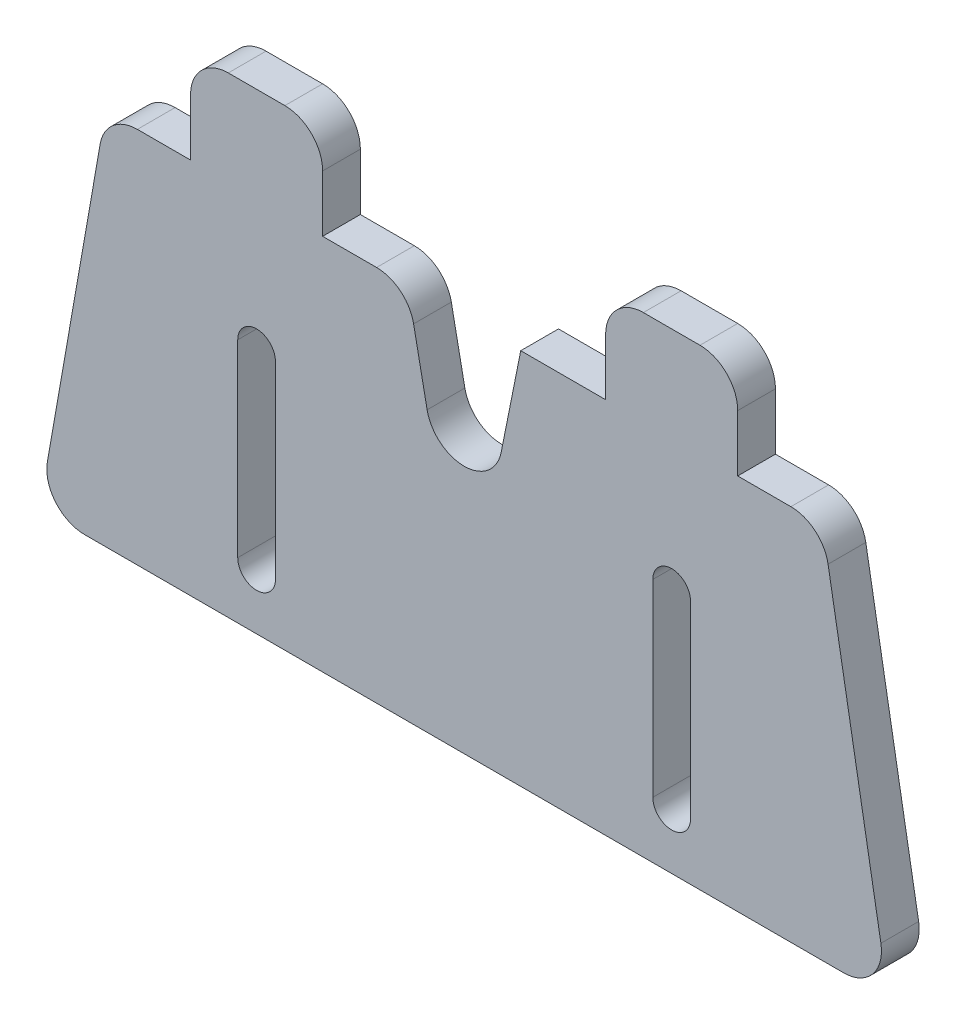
SolidWorks part; units mm, degrees
ref_plane "Plano frontal" through (0, 0, 0) normal (0, 0, 1) x (1, 0, 0)
ref_plane "Plano superior" through (0, 0, 0) normal (0, 1, 0) x (1, 0, 0)
ref_plane "Plano direito" through (0, 0, 0) normal (1, 0, 0) x (0, 0, -1)
sketch "Esboço1" plane through (0, 0, 0) normal (0, 0, 1) x (1, 0, 0)
  line L0 (0, -12.5) -> (0, 12.5) construction
  line L1 (-22.5, 12.5) -> (22.5, 12.5)
  line L2 (-22.5, 12.5) -> (-22.5, -12.5)
  line L3 (-22.5, -12.5) -> (22.5, -12.5)
  line L4 (22.5, 12.5) -> (22.5, -12.5)
  line L5 (-22.5, 12.5) -> (22.5, -12.5) construction
  line L6 (-22.5, -12.5) -> (22.5, 12.5) construction
  line L7 (-11, 0.5) -> (-11, -9.5) construction
  line L8 (-10, 0.5) -> (-10, -9.5)
  line L9 (-12, 0.5) -> (-12, -9.5)
  line L10 (-22.5, -12.5) -> (-19, 7.5)
  line L11 (-14.5, 7.5) -> (-19, 7.5)
  line L12 (-14.5, 7.5) -> (-14.5, 12.5)
  line L13 (-14.5, 12.5) -> (-7.5, 12.5)
  line L14 (-7.5, 12.5) -> (-7.5, 7.5)
  line L15 (-7.5, 7.5) -> (-3, 7.5)
  line L16 (-3, 7.5) -> (0, -7.5)
  line L17 (-11, -10.5) -> (-11, 12.5) construction
  line L18 (11, 0.5) -> (11, -9.5) construction
  line L19 (10, 0.5) -> (10, -9.5)
  line L20 (12, 0.5) -> (12, -9.5)
  line L21 (3, 7.5) -> (0, -7.5)
  line L22 (7.5, 7.5) -> (3, 7.5)
  line L23 (7.5, 12.5) -> (7.5, 7.5)
  line L24 (14.5, 7.5) -> (14.5, 12.5)
  line L25 (14.5, 7.5) -> (19, 7.5)
  line L26 (22.5, -12.5) -> (19, 7.5)
  arc A0 (-10, 0.5) -> (-12, 0.5) centre (-11, 0.5) ccw
  arc A1 (-12, -9.5) -> (-10, -9.5) centre (-11, -9.5) ccw
  arc A2 (10, 0.5) -> (12, 0.5) centre (11, 0.5) cw
  arc A3 (12, -9.5) -> (10, -9.5) centre (11, -9.5) cw
  point P0 (0, 0)
  point P10 (-11, -4.5)
  point P26 (11, -4.5)
  dimension "D6" = 11
  dimension "D1" = 45
  dimension "D2" = 25
  dimension "D3" = 2
  dimension "D4" = 2
  dimension "D5" = 10
  dimension "D7" = 5
  dimension "D8" = 7
  dimension "D9" = 16
  dimension "D10" = 5
extrude "Ressalto-extrusão1" add sketch "Esboço1" along normal blind 2 contours L3 L26 L25 L24 L1 L23 L22 L21 L16 L15 L14 L12 L11 L10 A1 L9 A0 L8 L20 A3 L19 A2
fillet "Filete1" radius 2 10 edges at (22.5, -12.5, 1) (-22.5, -12.5, 1) (0, -7.5, 1) (-19, 7.5, 1) (-3, 7.5, 1) (19, 7.5, 1) (14.5, 12.5, 1) (7.5, 12.5, 1) (-14.5, 12.5, 1) (-7.5, 12.5, 1)
